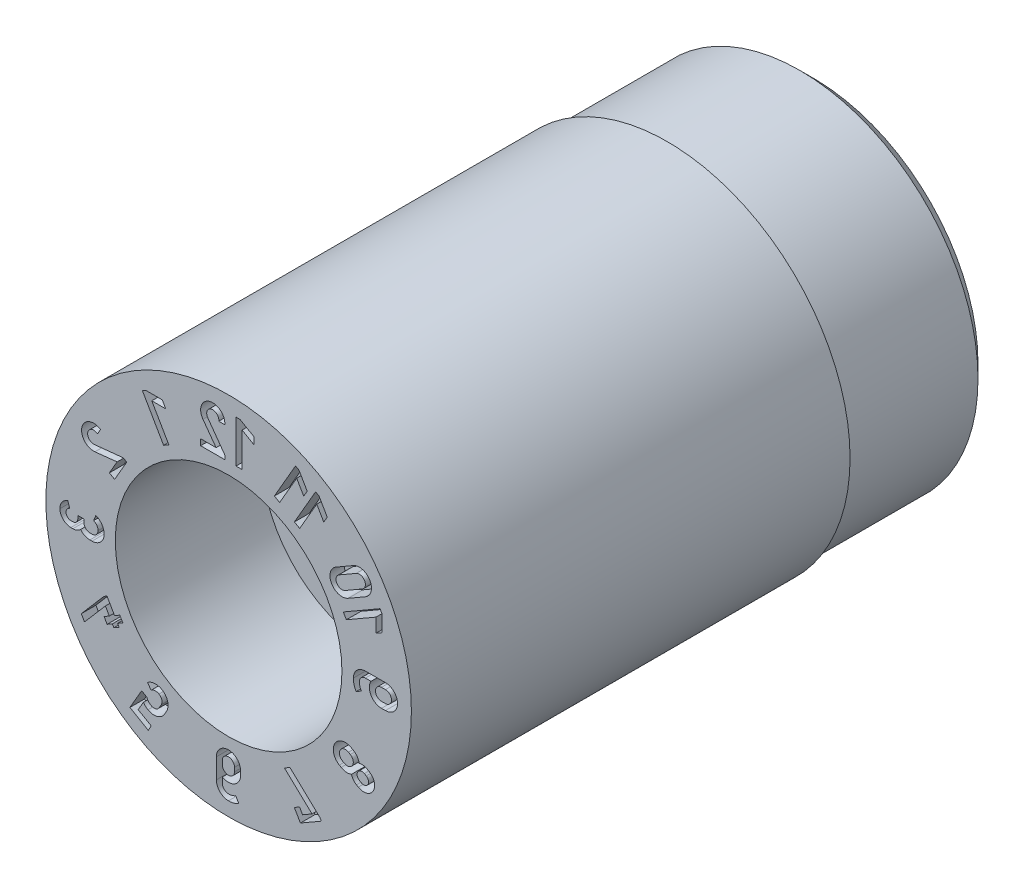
SolidWorks part; units mm, degrees
ref_plane "Front Plane" through (0, 0, 0) normal (0, 0, 1) x (1, 0, 0)
ref_plane "Top Plane" through (0, 0, 0) normal (0, 1, 0) x (1, 0, 0)
ref_plane "Right Plane" through (0, 0, 0) normal (1, 0, 0) x (0, 0, -1)
sketch "Sketch1" plane through (0, 0, 0) normal (1, 0, 0) x (0, 0, -1)
  line L2 (0, 2.5) -> (0, 1.55)
  line L3 (7.75, 2.5) -> (0, 2.5)
  line L4 (-3.7979, 0) -> (49996.2021, 0) construction
  line L8 (8, 0.8) -> (2, 0.8)
  line L9 (2, 1.55) -> (2, 0.8)
  line L10 (2, 1.55) -> (0, 1.55)
  line L12 (8, 0.8) -> (8, 2.25)
  line L16 (8, 2.25) -> (7.75, 2.5)
  dimension "D1" = 8
  dimension "D2" = 45
  dimension "D3" = 0.25
  dimension "D4" = 5
  dimension "D5" = 3.1
  dimension "D6" = 2
  dimension "D7" = 1.6
revolve "Revolve1" add sketch "Sketch1" angle 360 about L4
sketch "Sketch4" plane through (0, 0, 0) normal (1, 0, 0) x (0, 0, -1)
  line L0 (0, 0) -> (50000, 0) construction
  line L1 (8, -2.25) -> (8, 2.25) construction
  line L2 (6, 3.435) -> (8, 3.435)
  line L3 (6, 3.435) -> (6, 2.435)
  line L4 (6, 2.435) -> (8, 2.435)
  line L5 (8, 3.435) -> (8, 2.435)
  line L6 (7.75, 2.5) -> (0, 2.5) construction
  line L7 (0, 2.5) -> (0, -2.5) construction
  dimension "D1" = 1
  dimension "D2" = 0.065
  dimension "D3" = 6
revolve "Cut-Revolve1" cut sketch "Sketch4" angle 360 about L0
sketch "Sketch2" plane through (0, 0, 0) normal (0, 0, 1) x (1, 0, 0)
  line L0 (1.1898, 1.9464) -> (1.237, 1.9192)
  line L1 (1.237, 1.9192) -> (1.3491, 1.7257)
  line L2 (1.3491, 1.7257) -> (1.3014, 1.643)
  line L3 (1.3014, 1.643) -> (1.2056, 1.8082)
  line L4 (1.2056, 1.8082) -> (0.9717, 1.4031)
  line L5 (0.9717, 1.4031) -> (0.9, 1.4445)
  line L6 (0.9, 1.4445) -> (1.1898, 1.9464)
  line L7 (0.9154, 2.1161) -> (0.9626, 2.0889)
  line L8 (0.9626, 2.0889) -> (1.0747, 1.8954)
  line L9 (1.0747, 1.8954) -> (1.027, 1.8127)
  line L10 (1.027, 1.8127) -> (0.9312, 1.9779)
  line L11 (0.9312, 1.9779) -> (0.6973, 1.5728)
  line L12 (0.6973, 1.5728) -> (0.6256, 1.6142)
  line L13 (0.6256, 1.6142) -> (0.9154, 2.1161)
  line L14 (1.593, 0.9787) -> (1.8296, 1.1153)
  line L15 (1.7468, 1.2587) -> (1.5102, 1.1221)
  line L16 (2.1448, 0.0806) -> (2.091, 0.0806)
  line L17 (2.091, -0.085) -> (2.1448, -0.085)
  line L18 (2.1448, 0.1634) -> (1.8715, 0.1633)
  line L19 (1.745, -0.143) -> (1.8161, -0.1003)
  line L20 (2.1447, -0.1678) -> (2.091, -0.168)
  line L21 (1.9475, 0.0806) -> (1.8715, 0.0806)
  line L22 (1.7902, -1.1733) -> (1.8153, -1.1878)
  line L23 (1.8815, -1.0731) -> (1.8564, -1.0586)
  line L24 (0.7635, -1.5382) -> (0.8384, -1.495)
  line L25 (0.8384, -1.495) -> (1.2485, -1.8816)
  line L26 (1.2485, -1.8816) -> (1.2684, -1.916)
  line L27 (1.2684, -1.916) -> (0.9816, -2.0816)
  line L28 (0.9816, -2.0816) -> (0.8988, -1.9382)
  line L29 (0.8988, -1.9382) -> (0.9705, -1.8968)
  line L30 (0.9705, -1.8968) -> (1.0119, -1.9684)
  line L31 (1.0119, -1.9684) -> (1.1409, -1.8939)
  line L32 (1.1409, -1.8939) -> (0.7635, -1.5382)
  line L33 (1.556, -1.0572) -> (1.5811, -1.0717)
  line L34 (1.6639, -0.9283) -> (1.6388, -0.9138)
  line L35 (1.7053, -0.8566) -> (1.6802, -0.8421)
  line L36 (1.5146, -1.1289) -> (1.5397, -1.1434)
  line L37 (1.7488, -1.245) -> (1.7739, -1.2595)
  line L38 (1.9229, -1.0014) -> (1.8978, -0.9869)
  line L39 (2.071, 1.0024) -> (2.0983, 0.9552)
  line L40 (2.0983, 0.9552) -> (2.0986, 0.7315)
  line L41 (2.0986, 0.7315) -> (2.0159, 0.6838)
  line L42 (2.0159, 0.6838) -> (2.0156, 0.8748)
  line L43 (2.0156, 0.8748) -> (1.6105, 0.6409)
  line L44 (1.6105, 0.6409) -> (1.5691, 0.7126)
  line L45 (1.5691, 0.7126) -> (2.071, 1.0024)
  line L46 (1.7054, 1.3305) -> (1.4688, 1.1939)
  line L47 (1.6344, 0.907) -> (1.871, 1.0436)
  line L48 (0.1016, 2.2866) -> (0.1561, 2.2866)
  line L49 (0.1561, 2.2866) -> (0.35, 2.1751)
  line L50 (0.35, 2.1751) -> (0.35, 2.0796)
  line L51 (0.35, 2.0796) -> (0.1844, 2.1748)
  line L52 (0.1844, 2.1748) -> (0.1844, 1.707)
  line L53 (0.1844, 1.707) -> (0.1016, 1.707)
  line L54 (0.1016, 1.707) -> (0.1016, 2.2866)
  line L55 (-0.3825, 1.7058) -> (-0.0513, 1.7058)
  line L56 (-0.0513, 1.7058) -> (-0.0513, 1.7605)
  line L57 (-0.0513, 1.7605) -> (-0.2841, 2.0838)
  line L58 (-0.135, 2.1197) -> (-0.0517, 2.1197)
  line L59 (-0.3514, 2.0353) -> (-0.1713, 1.7886)
  line L60 (-0.1713, 1.7886) -> (-0.3825, 1.7886)
  line L61 (-0.3825, 1.7886) -> (-0.3825, 1.7058)
  line L62 (-1.1789, 1.9591) -> (-1.1317, 1.9864)
  line L63 (-1.1317, 1.9864) -> (-0.9081, 1.9868)
  line L64 (-0.9081, 1.9868) -> (-0.8603, 1.9041)
  line L65 (-0.8603, 1.9041) -> (-1.0513, 1.9037)
  line L66 (-1.0513, 1.9037) -> (-0.8174, 1.4986)
  line L67 (-0.8174, 1.4986) -> (-0.8891, 1.4572)
  line L68 (-0.8891, 1.4572) -> (-1.1789, 1.9591)
  line L69 (-0.085, -1.8716) -> (-0.085, -1.9254)
  line L70 (0.0805, -1.9254) -> (0.0805, -1.8716)
  line L71 (0.1633, -1.8717) -> (0.1635, -1.9254)
  line L72 (-0.085, -2.0688) -> (-0.085, -2.1448)
  line L73 (-0.1679, -1.8716) -> (-0.1678, -2.1448)
  line L74 (0.1385, -2.2714) -> (0.0958, -2.2003)
  line L75 (-0.8504, -1.6746) -> (-0.8774, -1.7211)
  line L76 (-1.1897, -1.5999) -> (-1.118, -1.6413)
  line L77 (-0.949, -1.6798) -> (-0.9221, -1.6332)
  line L78 (-1.0593, -1.528) -> (-1.1108, -1.4631)
  line L79 (-1.1897, -1.5999) -> (-1.3504, -1.8782)
  line L80 (-1.3504, -1.8782) -> (-1.0995, -2.0231)
  line L81 (-1.0995, -2.0231) -> (-1.058, -1.9514)
  line L82 (-1.058, -1.9514) -> (-1.2373, -1.8479)
  line L83 (-1.2373, -1.8479) -> (-1.1666, -1.7254)
  line L84 (-2.1585, -0.1509) -> (-2.1295, -0.1509)
  line L85 (-1.8977, -0.1674) -> (-1.8687, -0.1674)
  line L86 (-1.8158, 0.1638) -> (-1.8462, 0.0868)
  line L87 (-2.2006, 0.1472) -> (-2.1741, 0.0688)
  line L88 (-2.1585, -0.068) -> (-2.1295, -0.068)
  line L89 (-2.0633, -0.0018) -> (-2.0633, 0.0396)
  line L90 (-2.0633, 0.0396) -> (-1.9805, 0.0396)
  line L91 (-1.9805, 0.0396) -> (-1.9805, -0.0018)
  line L92 (-1.8977, -0.0846) -> (-1.8687, -0.0846)
  line L93 (-2.0153, -1.1001) -> (-1.9714, -1.176)
  line L94 (-1.9714, -1.176) -> (-1.6853, -0.8435)
  line L95 (-1.6853, -0.8435) -> (-1.6317, -0.9364)
  line L96 (-1.6317, -0.9364) -> (-1.7034, -0.9778)
  line L97 (-1.7034, -0.9778) -> (-1.662, -1.0495)
  line L98 (-1.662, -1.0495) -> (-1.5903, -1.0081)
  line L99 (-1.5903, -1.0081) -> (-1.5696, -1.044)
  line L100 (-1.5696, -1.044) -> (-1.4979, -1.0026)
  line L101 (-1.4979, -1.0026) -> (-1.5186, -0.9667)
  line L102 (-1.5186, -0.9667) -> (-1.4469, -0.9253)
  line L103 (-1.4469, -0.9253) -> (-1.4883, -0.8536)
  line L104 (-1.4883, -0.8536) -> (-1.56, -0.895)
  line L105 (-1.56, -0.895) -> (-1.6635, -0.7158)
  line L106 (-1.6635, -0.7158) -> (-1.7054, -0.74)
  line L107 (-1.7054, -0.74) -> (-2.0153, -1.1001)
  line L108 (-1.6306, 0.7605) -> (-1.5589, 0.7191)
  line L109 (-1.5589, 0.7191) -> (-1.3933, 1.0059)
  line L110 (-1.3933, 1.0059) -> (-1.4408, 1.0333)
  line L111 (-1.4408, 1.0333) -> (-1.8371, 0.9933)
  line L112 (-1.7937, 1.1404) -> (-1.7521, 1.2125)
  line L113 (-1.8288, 0.9108) -> (-1.5251, 0.9434)
  line L114 (-1.5251, 0.9434) -> (-1.6306, 0.7605)
  arc A0 (1.5102, 1.1221) -> (1.593, 0.9787) centre (1.5516, 1.0504) ccw
  arc A1 (1.8296, 1.1153) -> (1.7468, 1.2587) centre (1.7882, 1.187) ccw
  arc A2 (2.091, 0.0806) -> (2.091, -0.085) centre (2.091, -0.0022) ccw
  arc A3 (2.1448, -0.085) -> (2.1448, 0.0806) centre (2.1448, -0.0022) ccw
  arc A4 (1.8715, 0.1633) -> (1.7059, -0.0022) centre (1.8716, -0.0023) ccw
  arc A5 (1.7059, -0.0022) -> (1.745, -0.143) centre (1.979, -0.0023) ccw
  arc A6 (2.1447, -0.1678) -> (2.1448, 0.1634) centre (2.1447, -0.0022) ccw
  arc A7 (1.9475, 0.0806) -> (2.091, -0.168) centre (2.0904, -0.0027) ccw
  arc A8 (1.8715, 0.0806) -> (1.789, 0.0041) centre (1.8715, -0.0022) ccw
  arc A9 (1.789, 0.0041) -> (1.8161, -0.1003) centre (1.9547, -0.0086) ccw
  arc A10 (1.8564, -1.0586) -> (1.7902, -1.1733) centre (1.8232, -1.1159) ccw
  arc A11 (1.8153, -1.1878) -> (1.8815, -1.0731) centre (1.8484, -1.1304) ccw
  arc A12 (1.6388, -0.9138) -> (1.556, -1.0572) centre (1.5975, -0.9855) ccw
  arc A13 (1.5811, -1.0717) -> (1.6639, -0.9283) centre (1.6225, -1) ccw
  arc A14 (1.7857, -0.9717) -> (1.7053, -0.8566) centre (1.6225, -1) ccw
  arc A15 (1.6802, -0.8421) -> (1.5146, -1.1289) centre (1.5973, -0.9855) ccw
  arc A16 (1.5397, -1.1434) -> (1.6796, -1.1554) centre (1.6225, -1) ccw
  arc A17 (1.6796, -1.1554) -> (1.7488, -1.245) centre (1.8235, -1.1158) ccw
  arc A18 (1.7739, -1.2595) -> (1.9229, -1.0014) centre (1.8484, -1.1305) ccw
  arc A19 (1.8978, -0.9869) -> (1.7857, -0.9717) centre (1.8235, -1.1147) ccw
  arc A20 (1.4688, 1.1939) -> (1.6344, 0.907) centre (1.5516, 1.0504) ccw
  arc A21 (1.871, 1.0436) -> (1.7054, 1.3305) centre (1.7882, 1.187) ccw
  arc A22 (-0.135, 2.1197) -> (-0.2841, 2.0838) centre (-0.2169, 2.1322) ccw
  arc A23 (-0.0517, 2.1197) -> (-0.3514, 2.0353) centre (-0.2169, 2.1321) ccw
  arc A24 (-0.085, -1.9254) -> (0.0805, -1.9254) centre (-0.0023, -1.9254) ccw
  arc A25 (0.0805, -1.8716) -> (-0.085, -1.8716) centre (-0.0023, -1.8716) ccw
  arc A26 (0.1633, -1.8717) -> (-0.1679, -1.8716) centre (-0.0023, -1.8717) ccw
  arc A27 (-0.085, -2.0688) -> (0.1635, -1.9254) centre (-0.0018, -1.926) ccw
  arc A28 (-0.085, -2.1448) -> (-0.0086, -2.2274) centre (-0.0023, -2.1448) ccw
  arc A29 (-0.0086, -2.2274) -> (0.0958, -2.2003) centre (0.0041, -2.0617) ccw
  arc A30 (-0.1678, -2.1448) -> (-0.0023, -2.3104) centre (-0.0022, -2.1448) ccw
  arc A31 (-0.0023, -2.3104) -> (0.1385, -2.2714) centre (-0.0022, -2.0374) ccw
  arc A32 (-1.1035, -1.7818) -> (-0.8774, -1.7211) centre (-1.0209, -1.638) ccw
  arc A33 (-1.1666, -1.7254) -> (-1.1035, -1.7818) centre (-1.0012, -1.6038) ccw
  arc A34 (-0.8504, -1.6746) -> (-0.911, -1.4483) centre (-0.994, -1.5918) ccw
  arc A35 (-0.911, -1.4483) -> (-1.1108, -1.4631) centre (-1.0001, -1.6024) ccw
  arc A36 (-1.118, -1.6413) -> (-1.0621, -1.7101) centre (-0.9999, -1.6024) ccw
  arc A37 (-1.0621, -1.7101) -> (-0.949, -1.6798) centre (-1.0207, -1.6384) ccw
  arc A38 (-0.9221, -1.6332) -> (-0.9524, -1.5201) centre (-0.9938, -1.5918) ccw
  arc A39 (-0.9524, -1.5201) -> (-1.0593, -1.528) centre (-1, -1.6026) ccw
  arc A40 (-2.2006, 0.1472) -> (-2.3075, -0.0018) centre (-2.1502, -0.0018) ccw
  arc A41 (-2.3075, -0.0018) -> (-2.1585, -0.1509) centre (-2.1585, -0.0018) ccw
  arc A42 (-2.1295, -0.1509) -> (-2.0249, -0.1079) centre (-2.1295, -0.0019) ccw
  arc A43 (-2.0249, -0.1079) -> (-1.8977, -0.1674) centre (-1.8977, -0.0019) ccw
  arc A44 (-1.8687, -0.1674) -> (-1.7032, -0.0018) centre (-1.8687, -0.0018) ccw
  arc A45 (-1.7032, -0.0018) -> (-1.8158, 0.1638) centre (-1.8812, -0.0018) ccw
  arc A46 (-2.1741, 0.0688) -> (-2.2247, -0.0018) centre (-2.1503, -0.0017) ccw
  arc A47 (-2.2247, -0.0018) -> (-2.1585, -0.068) centre (-2.1584, -0.0017) ccw
  arc A48 (-2.1295, -0.068) -> (-2.0633, -0.0018) centre (-2.1295, -0.0018) ccw
  arc A49 (-1.9805, -0.0018) -> (-1.8977, -0.0846) centre (-1.8977, -0.0018) ccw
  arc A50 (-1.8687, -0.0846) -> (-1.7859, -0.0018) centre (-1.8687, -0.0018) ccw
  arc A51 (-1.7859, -0.0018) -> (-1.8462, 0.0868) centre (-1.8812, -0.0018) ccw
  arc A52 (-1.7937, 1.1404) -> (-1.8371, 0.9933) centre (-1.8454, 1.0757) ccw
  arc A53 (-1.7521, 1.2125) -> (-1.8288, 0.9108) centre (-1.8454, 1.0756) ccw
extrude "Cut-Extrude1" cut sketch "Sketch2" against normal blind 0.2
